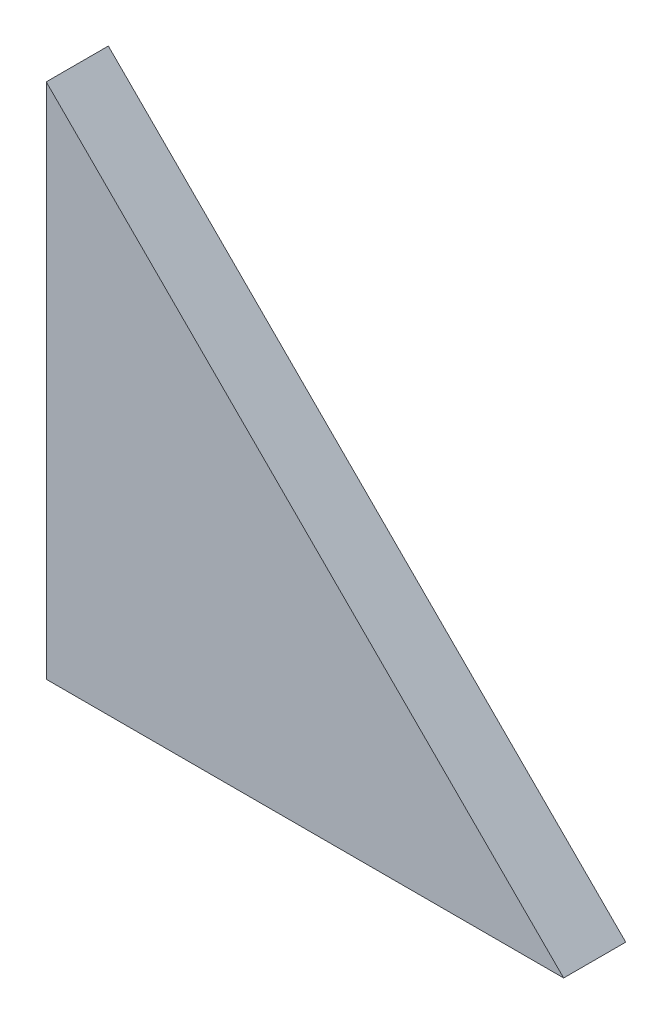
SolidWorks part; units mm, degrees
ref_plane "Face" through (0, 0, 0) normal (0, 0, 1) x (1, 0, 0)
ref_plane "Dessus" through (0, 0, 0) normal (0, 1, 0) x (1, 0, 0)
ref_plane "Droite" through (0, 0, 0) normal (1, 0, 0) x (0, 0, -1)
sketch "Esquisse1" plane through (0, 0, 0) normal (0, 0, 1) x (1, 0, 0)
  line L0 (0, 0) -> (0, 100)
  line L1 (0, 100) -> (100, 0)
  line L2 (100, 0) -> (0, 0)
  dimension "D1" = 100
extrude "Base-Extrusion" add sketch "Esquisse1" along normal blind 12
